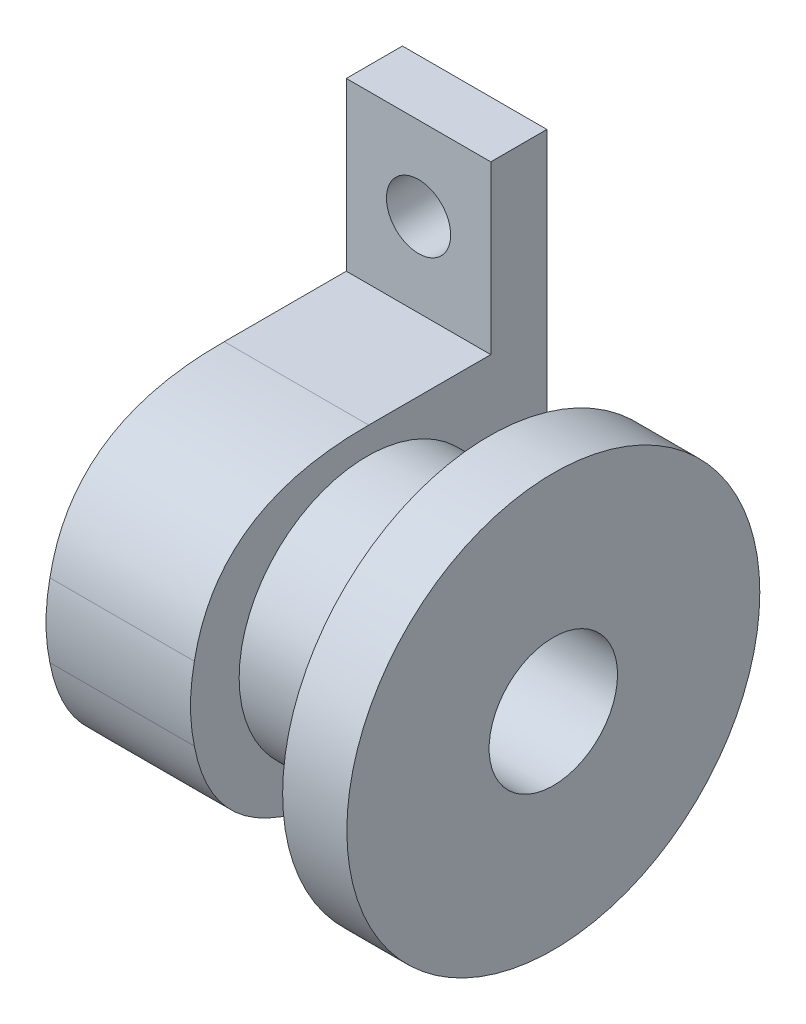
SolidWorks part; units mm, degrees
ref_plane "Front Plane" through (0, 0, 0) normal (1, 0, 0) x (0, 1, 0)
ref_plane "Top Plane" through (0, 0, 0) normal (0, 0, 1) x (0, 1, 0)
ref_plane "Right Plane" through (0, 0, 0) normal (0, 1, 0) x (-1, 0, 0)
sketch "Sketch1" plane through (0, 0, 0) normal (0, 0, 1) x (0, 1, 0)
  line L0 (-50, 0) -> (50, 0)
  line L1 (-50, 0) -> (-50, -22.5)
  line L2 (-50, -22.5) -> (50, -22.5)
  line L3 (50, -22.5) -> (50, 0)
  point P4 (0, 0)
  dimension "D1" = 100
  dimension "D2" = 22.5
extrude "Boss-Extrude1" add sketch "Sketch1" along normal blind 55.5
sketch "Sketch2" plane through (22.5, 0, 0) normal (1, 0, 0) x (0, 1, 0)
  line L0 (0, 0) -> (0, 0.5)
  line L1 (-24, 0) -> (-24, 55.5)
  line L2 (-50, 0) -> (50, 0) construction
  line L4 (-50, 55.5) -> (-50, 0) construction
  line L5 (50, 55.5) -> (50, 0) construction
  line L6 (19.6311, 8.742) -> (50, 8.742)
  line L8 (50, 55.5) -> (50, 14.5743)
  line L10 (-50, 55.5) -> (50, 55.5) construction
  line L12 (24, 0) -> (24, 55.5)
  line L13 (0, 0.5) -> (0, 55.5)
  line L14 (-24, 8.742) -> (-19.6311, 8.742)
  line L15 (-24, 8.742) -> (-50, 8.742)
  circle A4 centre (0, 28) radius 27.5
  circle A5 centre (0, 28) radius 10
  spline S0 degree 2 poles (0, 55.5) (-24.2004, 54.7772) (-24, 27.75) knots 0 0 0 1 1 1
  spline S1 degree 2 poles (0, 55.5) (24.2004, 54.7772) (24, 27.75) knots 0 0 0 1 1 1
  dimension "D2" = 20
  dimension "D1" = 0.5
extrude "Cut-Extrude1" cut sketch "Sketch2" against normal through all contours A4 L1 L15 M8 M9 | S0 L1 A4 | S0 A4 L1 | S0 A4 L1 M8 | L13 A5 | L13 A5 | A4 S1 L12 M8 | A4 L12 L6 M7 M8 | L12 S1 A4 | A4 S1 L12
sketch "Sketch3" plane through (0, 0, 8.742) normal (0, 0, 1) x (1, 0, 0)
  line L0 (22.5, 50) -> (0, 24)
  circle A0 centre (11.25, 37) radius 5
  dimension "D1" = 10
extrude "Cut-Extrude2" cut sketch "Sketch3" against normal through all contours L0 A0 | L0 A0
sketch "Sketch5" plane through (0, 0, 8.742) normal (0, 0, 1) x (1, 0, 0)
  line L0 (0, -24) -> (22.5, -50)
  circle A0 centre (11.25, -37) radius 4.9984
extrude "Cut-Extrude3" cut sketch "Sketch5" against normal through all contours L0 A0 | L0 A0
sketch "Sketch6" plane through (0, 0, 0) normal (-1, 0, 0) x (0, -1, 0)
  circle A0 centre (0, 28) radius 12
  dimension "D1" = 24
extrude "Boss-Extrude2" add sketch "Sketch6" along normal blind 5 contours A0 M1
sketch "Sketch7" plane through (22.5, 0, 0) normal (1, 0, 0) x (0, 1, 0)
  circle A1 centre (0, 28) radius 19.9274
  point P4 (12.7333, 23.4598)
extrude "Boss-Extrude3" add sketch "Sketch7" along normal blind 19
sketch "Sketch9" plane through (41.5, 0, 0) normal (1, 0, 0) x (0, 1, 0)
  circle A0 centre (0, 28) radius 32.1557
  circle A1 centre (0, 28) radius 10
extrude "Boss-Extrude5" add sketch "Sketch9" along normal blind 10
split "Split1" bodies to split 108 resulting bodies 109 110
